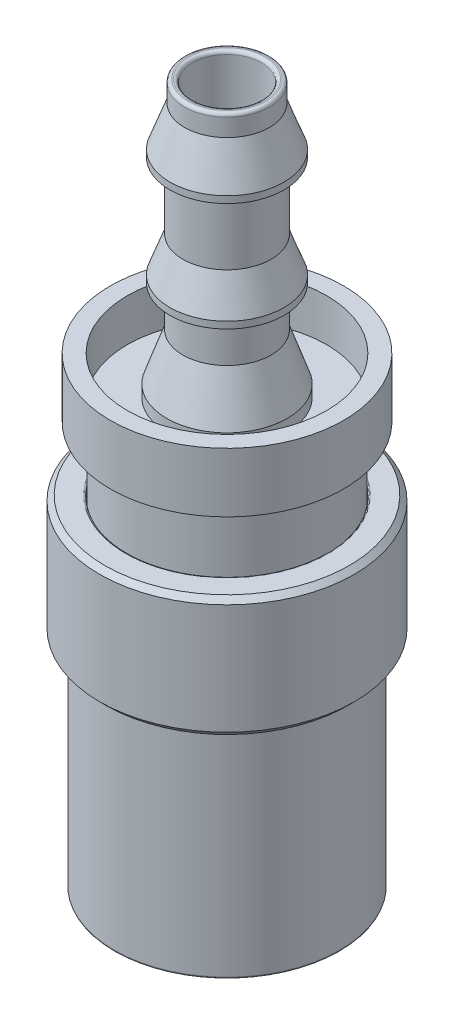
SolidWorks part; units mm, degrees
other "Body"
ref_plane "Front Plane" through (0, 0, 0) normal (0, 0, 1) x (1, 0, 0)
ref_plane "Top Plane" through (0, 0, 0) normal (0, 1, 0) x (1, 0, 0)
ref_plane "Right Plane" through (0, 0, 0) normal (1, 0, 0) x (0, 0, -1)
imported_body "SC200S"
imported_body "PL-BARB"
imported_body "BODY"
imported_body "SLEEVE"
sketch "Sketch3" plane through (0, 0, 0) normal (0, 0, 1) x (1, 0, 0)
  line L0 (-4.7752, 8.1191) -> (-3.175, 7.1952)
  line L1 (-3.175, 7.1952) -> (-3.175, 2.3876)
  line L2 (-3.175, 2.3876) -> (-4.7752, 0.7874)
  line L3 (-4.7752, 8.1191) -> (-4.7752, 0.7874)
  line L4 (-4.7752, 0.7874) -> (-5.5626, 0) construction
  line L7 (-5.0546, 8.2804) -> (-4.7752, 8.1191) construction
  line L8 (0, 6.2905) -> (0, -1.9798) construction
  line L9 (0, 0) -> (0, 15.24) construction
  dimension "D1" = 6.35
revolve "Revolve1" add sketch "Sketch3" angle 360 about L8
sketch "Sketch1" plane through (0, 0, 0) normal (0, -1, 0) x (1, 0, 0)
  line L1 (0, 5.2793) -> (-4.572, 2.6396)
  line L2 (-4.572, 2.6396) -> (-4.572, -2.6396)
  line L3 (-4.572, -2.6396) -> (0, -5.2793)
  line L4 (0, -5.2793) -> (4.572, -2.6396)
  line L5 (4.572, -2.6396) -> (4.572, 2.6396)
  line L6 (4.572, 2.6396) -> (0, 5.2793)
  circle A0 centre (0, 0) radius 4.572 construction
  dimension "D1" = 9.144
extrude "Cut-Extrude2" cut sketch "Sketch1" against normal up to surface (9.3689 mm away)
